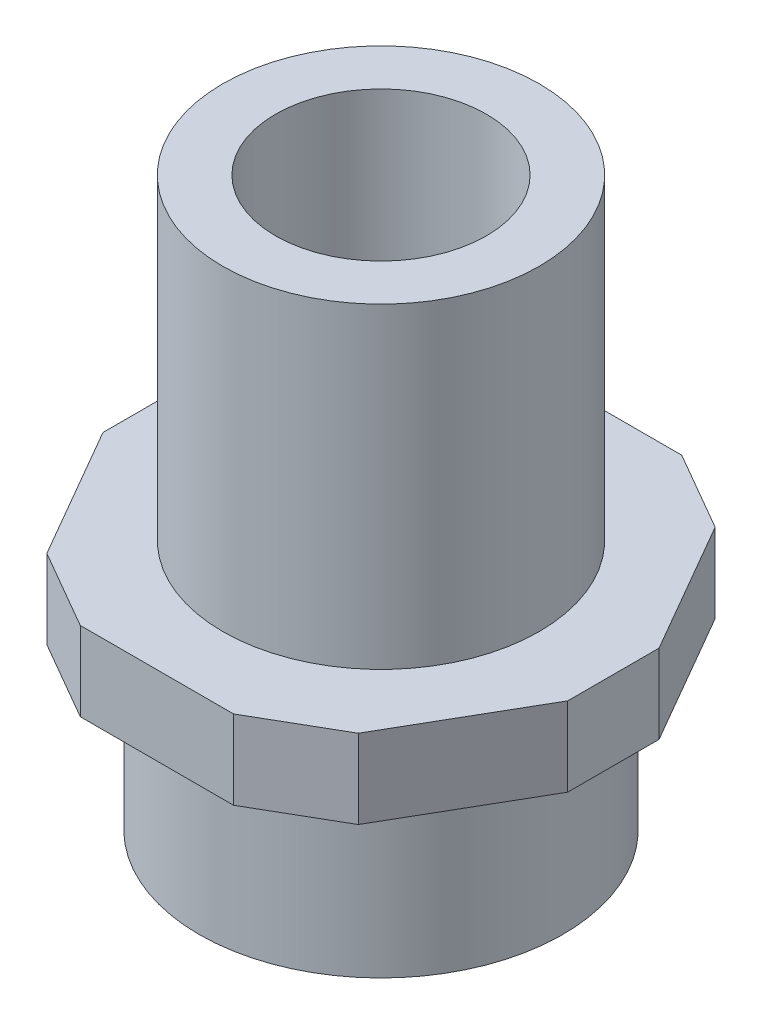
SolidWorks part; units mm, degrees
ref_plane "Plan de face" through (0, 0, 0) normal (0, 0, 1) x (1, 0, 0)
ref_plane "Plan de dessus" through (0, 0, 0) normal (0, 1, 0) x (1, 0, 0)
ref_plane "Plan de droite" through (0, 0, 0) normal (1, 0, 0) x (0, 0, -1)
sketch "Esquisse1" plane through (0, 0, 0) normal (0, 1, 0) x (1, 0, 0)
  line L1 (9.815, 0) -> (4.9075, 8.5)
  line L2 (4.9075, 8.5) -> (-4.9075, 8.5)
  line L3 (-4.9075, 8.5) -> (-9.815, 0)
  line L4 (-9.815, 0) -> (-4.9075, -8.5)
  line L5 (-4.9075, -8.5) -> (4.9075, -8.5)
  line L6 (4.9075, -8.5) -> (9.815, 0)
  circle A0 centre (0, 0) radius 8.5 construction
  dimension "D1" = 17
extrude "Extrusion1" add sketch "Esquisse1" along normal blind 3
sketch "Esquisse2" plane through (0, 3, 0) normal (0, 1, 0) x (1, 0, 0)
  circle A0 centre (0, 0) radius 6
  circle A1 centre (0, 0) radius 4
  dimension "D1" = 12
  dimension "D2" = 2
extrude "Extrusion2" add sketch "Esquisse2" along normal blind 12
sketch "Esquisse3" plane through (0, 0, 0) normal (0, -1, 0) x (1, 0, 0)
  circle A0 centre (0, 0) radius 6.9
  dimension "D1" = 13.8
extrude "Extrusion3" add sketch "Esquisse3" along normal blind 6.5
chamfer "Chanfrein1" distance 2 distance2 2 6 edges at (4.9075, 1.5, 8.5) (9.815, 1.5, 0) (4.9075, 1.5, -8.5) (-4.9075, 1.5, -8.5) (-4.9075, 1.5, 8.5) (-9.815, 1.5, 0)
